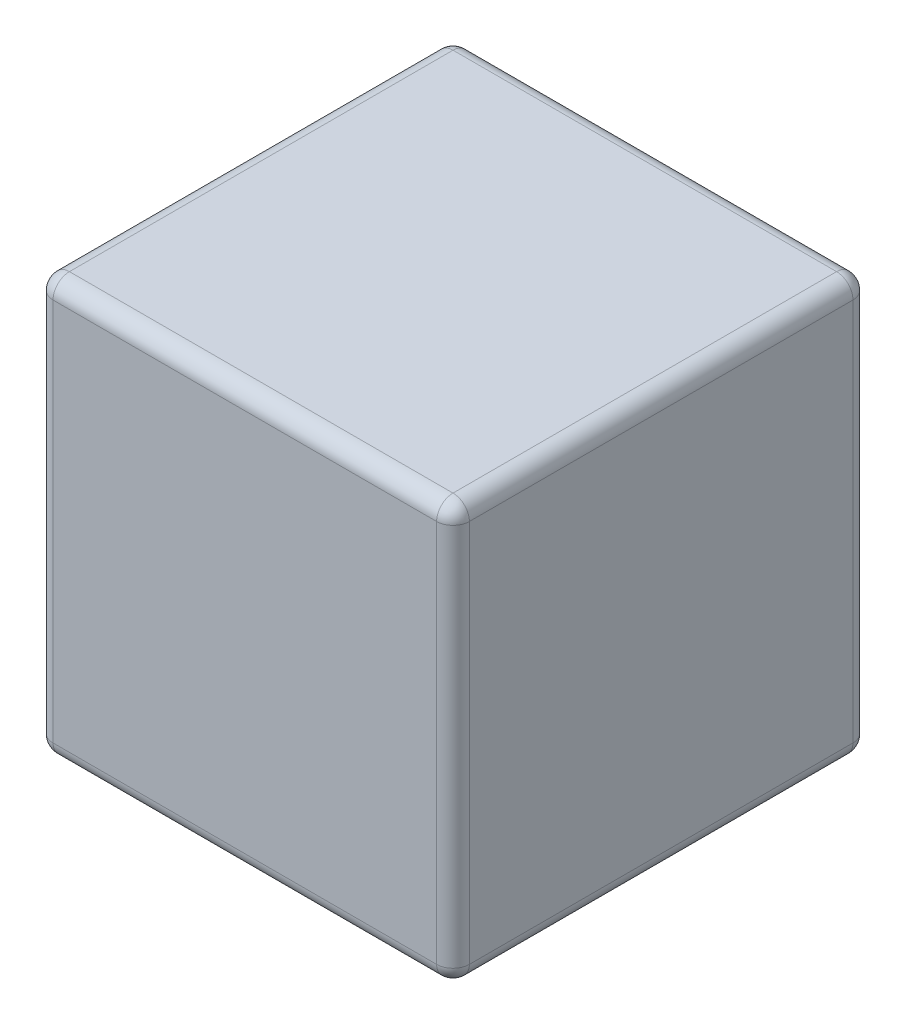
SolidWorks part; units mm, degrees
ref_plane "Front Plane" through (0, 0, 0) normal (0, 0, 1) x (1, 0, 0)
ref_plane "Top Plane" through (0, 0, 0) normal (0, 1, 0) x (1, 0, 0)
ref_plane "Right Plane" through (0, 0, 0) normal (1, 0, 0) x (0, 0, -1)
sketch "Sketch1" plane through (0, 0, 0) normal (0, 1, 0) x (1, 0, 0)
  line L1 (-12.7, -12.7) -> (12.7, -12.7)
  line L2 (-12.7, -12.7) -> (-12.7, 12.7)
  line L3 (-12.7, 12.7) -> (12.7, 12.7)
  line L4 (12.7, -12.7) -> (12.7, 12.7)
  line L5 (-12.7, -12.7) -> (12.7, 12.7) construction
  line L6 (-12.7, 12.7) -> (12.7, -12.7) construction
  point P0 (0, 0)
  dimension "D1" = 25.4
  dimension "D2" = 25.4
extrude "Boss-Extrude1" add sketch "Sketch1" along normal blind 25.4
fillet "Fillet1" radius 1 12 edges at (12.7, 0, 0) (12.7, 12.7, -12.7) (0, 0, -12.7) (-12.7, 12.7, -12.7) (-12.7, 0, 0) (-12.7, 25.4, 0) (0, 25.4, -12.7) (12.7, 25.4, 0) (-12.7, 12.7, 12.7) (0, 25.4, 12.7) (12.7, 12.7, 12.7) (0, 0, 12.7)
